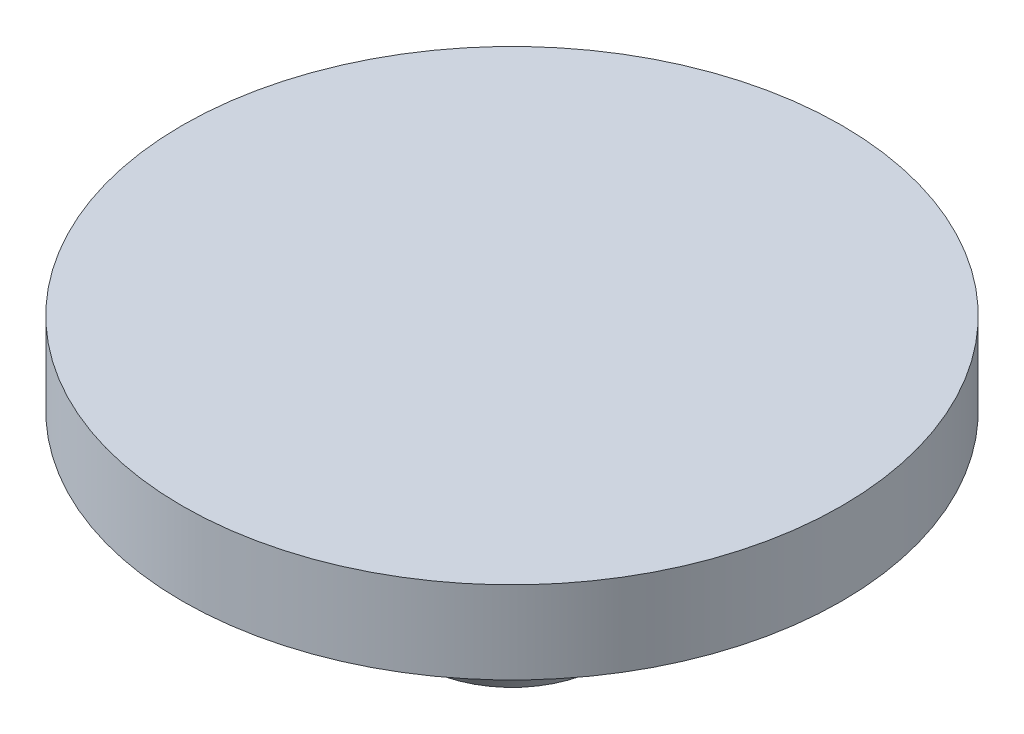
SolidWorks part; units mm, degrees
ref_plane "Front Plane" through (0, 0, 0) normal (0, 0, 1) x (1, 0, 0)
ref_plane "Top Plane" through (0, 0, 0) normal (0, 1, 0) x (1, 0, 0)
ref_plane "Right Plane" through (0, 0, 0) normal (1, 0, 0) x (0, 0, -1)
sketch "Sketch1" plane through (0, 0, 0) normal (0, 1, 0) x (1, 0, 0)
  circle A0 centre (0, 0) radius 12.7
  dimension "D1" = 25.4
extrude "Boss-Extrude1" add sketch "Sketch1" along normal blind 3.175
sketch "Sketch2" plane through (0, 0, 0) normal (0, -1, 0) x (1, 0, 0)
  circle A0 centre (0, 0) radius 4.7625
  dimension "D1" = 9.525
extrude "Boss-Extrude2" add sketch "Sketch2" along normal blind 1.5875
sketch "Sketch3" plane through (0, 0, 0) normal (1, 0, 0) x (0, 0, -1)
  line L0 (0, 0) -> (0, -8.3802) construction
  line L1 (-4.7625, -1.5875) -> (4.7625, -1.5875) construction
  line L2 (0, -1.5875) -> (6.35, -1.5875)
  line L3 (0, -6.7056) -> (3.5687, -6.7056)
  line L4 (3.5687, -6.7056) -> (6.35, -1.5875)
  line L5 (0, -1.5875) -> (0, -6.7056)
  line L6 (12.7, 3.175) -> (-12.7, 3.175) construction
  dimension "D1" = 7.1374
  dimension "D2" = 12.7
  dimension "D3" = 9.8806
revolve "Revolve1" add sketch "Sketch3" angle 360 about L0
